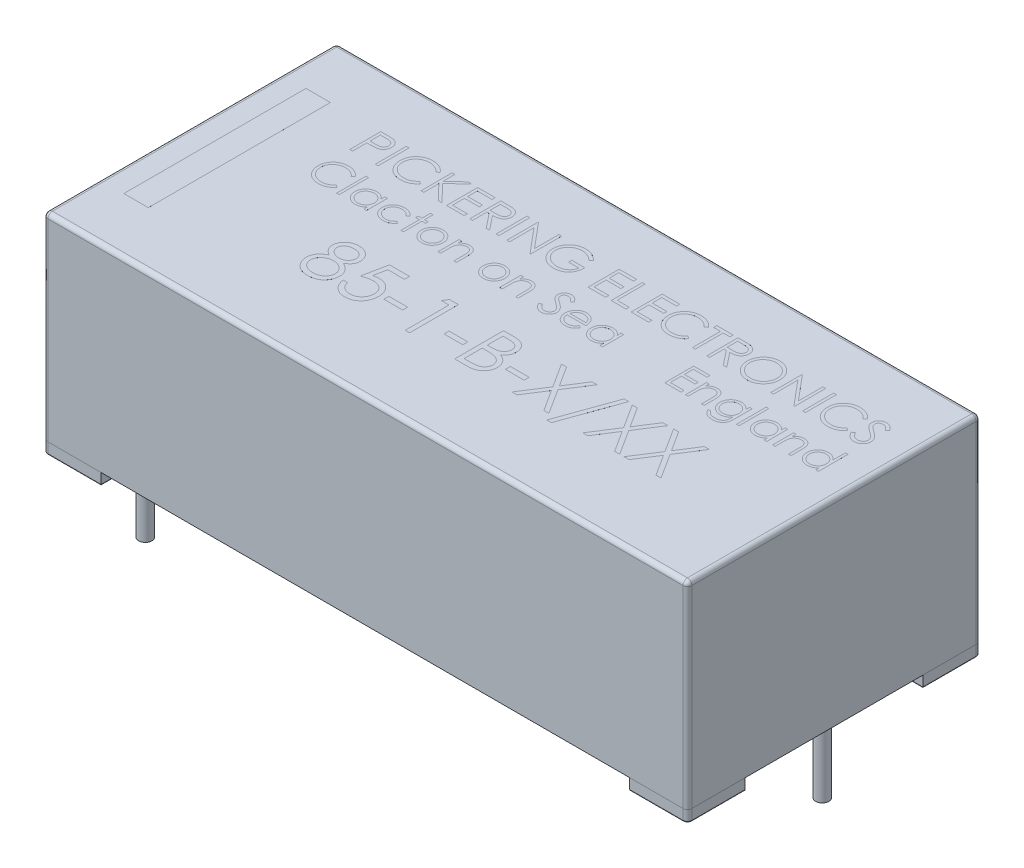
SolidWorks part; units mm, degrees
ref_plane "Front Plane" through (0, 0, 0) normal (0, 0, 1) x (1, 0, 0)
ref_plane "Top Plane" through (0, 0, 0) normal (0, 1, 0) x (1, 0, 0)
ref_plane "Right Plane" through (0, 0, 0) normal (1, 0, 0) x (0, 0, -1)
sketch "Sketch2" plane through (0, 0, 0) normal (0, 1, 0) x (1, 0, 0)
  line L1 (14.5, -6.6) -> (-14.5, -6.6)
  line L2 (14.5, -6.6) -> (14.5, 6.6)
  line L3 (14.5, 6.6) -> (-14.5, 6.6)
  line L4 (-14.5, -6.6) -> (-14.5, 6.6)
  line L5 (14.5, -6.6) -> (-14.5, 6.6) construction
  line L6 (14.5, 6.6) -> (-14.5, -6.6) construction
  point P0 (0, 0)
  dimension "D1" = 13.2
  dimension "D2" = 29
extrude "Main Body" add sketch "Sketch2" along normal blind 8.89 draft 0.023
sketch "Sketch9" plane through (0, 0, 0) normal (0, -1, 0) x (1, 0, 0)
  line L0 (-14.5, -6.6) -> (-14.5, 6.6) construction
  line L1 (-14.5, 6.6) -> (14.5, 6.6) construction
  circle A0 centre (-12.7, -3.81) radius 0.3
  circle A2 centre (-12.7, -1.27) radius 0.3
  circle A3 centre (-12.7, 3.81) radius 0.3
  dimension "D1" = 0.6
  dimension "D5" = 0.6
  dimension "D7" = 0.6
  dimension "D2" = 2.79
  dimension "D3" = 1.8
  dimension "D4" = 2.54
extrude "Left hand Pins" add sketch "Sketch9" along normal blind 4.31
sketch "Sketch10" plane through (0, 0, 0) normal (0, -1, 0) x (1, 0, 0)
  line L1 (14.5, 6.6) -> (11.9, 6.6)
  line L2 (14.5, 6.6) -> (14.5, 4)
  line L3 (14.5, 4) -> (11.9, 4)
  line L4 (11.9, 6.6) -> (11.9, 4)
  dimension "D1" = 2.6
  dimension "D2" = 2.6
extrude "Foot" add sketch "Sketch10" along normal blind 0.51
sketch "Sketch11" plane through (0, -0.51, 0) normal (0, -1, 0) x (1, 0, 0)
  line L0 (14.5, 6.6) -> (11.9, 6.6) construction
  line L1 (11.9, 4) -> (13.95, 4)
  line L2 (11.9, 4) -> (11.9, 6.05)
  line L3 (11.9, 6.05) -> (13.95, 6.05)
  line L4 (13.95, 4) -> (13.95, 6.05)
  line L5 (14.5, 4) -> (14.5, 6.6) construction
  dimension "D1" = 0.55
  dimension "D2" = 0.55
extrude "foot cut" cut sketch "Sketch11" against normal up to surface (0.51 mm away)
mirror "Mirror3" about plane through (0, 0, 0) normal (0, 0, 1) of "foot cut", "Foot"
mirror "Mirror4" about plane through (0, 0, 0) normal (1, 0, 0) of "Mirror3", "Foot", "foot cut"
sketch "Sketch12"
  dimension "D1" = 1.1
  dimension "D2" = 8.2
  dimension "D3" = 2.4965
  dimension "D4" = 1.4
  dimension "D5" = 2
  dimension "D6" = 3.8
extrude "Lettering" add sketch "Sketch12" along normal blind 0.0001
sketch "Sketch13" plane through (0, 0, 0) normal (0, -1, 0) x (1, 0, 0)
  line L1 (11.9, -6.6) -> (-11.9, -6.6) construction
  line L3 (14.5, 4) -> (14.5, -4) construction
  circle A0 centre (12.7, -1.27) radius 0.3
  dimension "D1" = 0.6
  dimension "D2" = 5.33
  dimension "D5" = 1.8
extrude "Right hand pins" add sketch "Sketch13" along normal blind 4.31
fillet "Fillet1" radius 0.2 12 edges at (14.5, -0.255, -6.6) (14.5, -0.255, 6.6) (-14.5, -0.255, 6.6) (-14.5, -0.255, -6.6) (14.4983, 4.445, -6.5983) (0, 8.89, -6.5965) (14.4983, 4.445, 6.5983) (14.4965, 8.89, 0) (-14.4983, 4.445, 6.5983) (-14.4983, 4.445, -6.5983) (-14.4965, 8.89, 0) (0, 8.89, 6.5965)
fillet "Fillet2" radius 0.05 28 edges at (-14.4414, -0.51, -6.5414) (-13.1, -0.51, -6.6) (-11.9, -0.51, -6.325) (-12.925, -0.51, -6.05) (-13.95, -0.51, -5.025) (-14.225, -0.51, -4) (-14.5, -0.51, -5.2) (14.4414, -0.51, 6.5414) (14.4414, -0.51, -6.5414) (-14.4414, -0.51, 6.5414) (13.1, -0.51, 6.6) (11.9, -0.51, 6.325) (12.925, -0.51, 6.05) (13.95, -0.51, 5.025) (14.225, -0.51, 4) (14.5, -0.51, 5.2) (14.5, -0.51, -5.2) (14.225, -0.51, -4) (13.95, -0.51, -5.025) (12.925, -0.51, -6.05) (11.9, -0.51, -6.325) (13.1, -0.51, -6.6) (-14.5, -0.51, 5.2) (-14.225, -0.51, 4) (-13.95, -0.51, 5.025) (-12.925, -0.51, 6.05) (-11.9, -0.51, 6.325) (-13.1, -0.51, 6.6)
